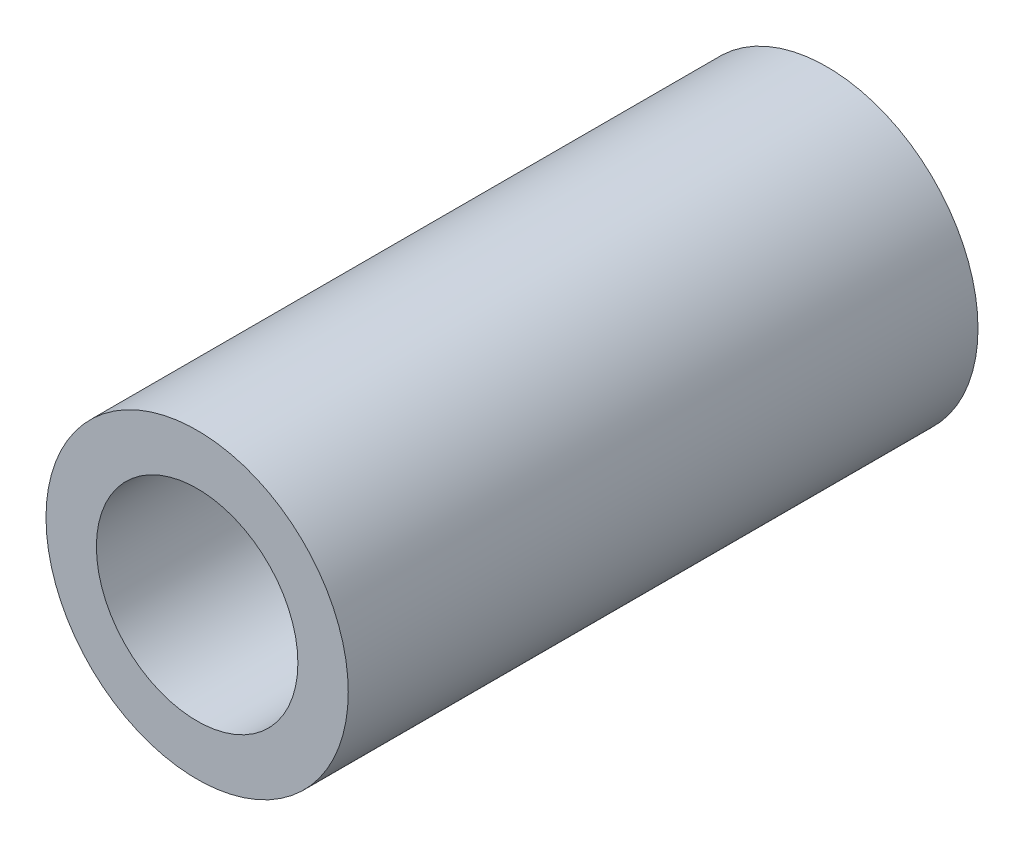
SolidWorks part; units mm, degrees
ref_plane "Plan de face" through (0, 0, 0) normal (0, 0, 1) x (1, 0, 0)
ref_plane "Plan de dessus" through (0, 0, 0) normal (0, 1, 0) x (1, 0, 0)
ref_plane "Plan de droite" through (0, 0, 0) normal (1, 0, 0) x (0, 0, -1)
sketch "Esquisse1" plane through (0, 0, 0) normal (0, 0, 1) x (1, 0, 0)
  circle A0 centre (0, 0) radius 3
  circle A1 centre (0, 0) radius 2
extrude "Extrusion1" add sketch "Esquisse1" along normal blind 12.5
